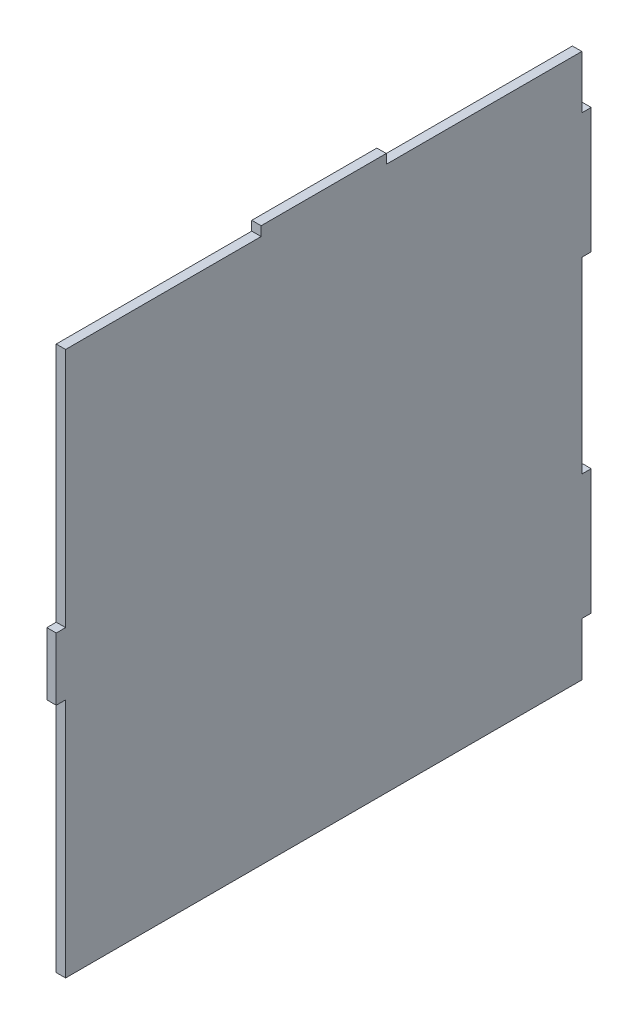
SolidWorks part; units mm, degrees
ref_plane "Front Plane" through (0, 0, 0) normal (0, 0, 1) x (1, 0, 0)
ref_plane "Top Plane" through (0, 0, 0) normal (0, 1, 0) x (1, 0, 0)
ref_plane "Right Plane" through (0, 0, 0) normal (1, 0, 0) x (0, 0, -1)
sketch "Sketch1" plane through (0, 0, 0) normal (0, 0, 1) x (1, 0, 0)
  line L1 (-1317.4158, 414.511) -> (-1311.4158, 414.511)
  line L2 (-1317.4158, 414.511) -> (-1317.4158, 66.511)
  line L3 (-1317.4158, 66.511) -> (-1311.4158, 66.511)
  line L4 (-1311.4158, 414.511) -> (-1311.4158, 66.511)
  line L6 (-1317.4158, 380.511) -> (-1311.4158, 380.511)
  line L7 (-1317.4158, 380.511) -> (-1317.4158, 300.511)
  line L8 (-1317.4158, 300.511) -> (-1311.4158, 300.511)
  line L9 (-1311.4158, 380.511) -> (-1311.4158, 300.511)
  line L10 (-1317.4158, 180.511) -> (-1311.4158, 180.511)
  line L11 (-1317.4158, 180.511) -> (-1317.4158, 100.511)
  line L12 (-1317.4158, 100.511) -> (-1311.4158, 100.511)
  line L13 (-1311.4158, 180.511) -> (-1311.4158, 100.511)
  dimension "D1" = 6
extrude "Boss-Extrude1" add sketch "Sketch1" along normal blind 330 contours L2 L6 L4 L1 | L2 L10 L4 L8 | L12 L2 L3 L4
sketch "Sketch2" plane through (-1311.4158, 0, 0) normal (1, 0, 0) x (0, 0, -1)
  line L0 (-330, 300.511) -> (0, 300.511) construction
  line L1 (0, 380.511) -> (6, 380.511)
  line L3 (0, 300.511) -> (6, 300.511)
  line L4 (6, 380.511) -> (6, 300.511)
  line L5 (0, 100.511) -> (0, 66.511) construction
  line L6 (0, 180.511) -> (6, 180.511)
  line L8 (0, 100.511) -> (6, 100.511)
  line L9 (6, 180.511) -> (6, 100.511)
  line L10 (0, 300.511) -> (0, 180.511)
  line L11 (-330, 414.511) -> (0, 414.511)
  line L12 (-330, 414.511) -> (-330, 66.511)
  line L13 (-330, 66.511) -> (0, 66.511)
  line L14 (0, 414.511) -> (0, 380.511)
  line L15 (0, 100.511) -> (0, 66.511)
  line L17 (-336, 220.511) -> (-324, 220.511)
  line L18 (-336, 220.511) -> (-336, 260.511)
  line L19 (-336, 260.511) -> (-324, 260.511)
  line L20 (-324, 220.511) -> (-324, 260.511)
  line L21 (-336, 220.511) -> (-324, 260.511) construction
  line L22 (-336, 260.511) -> (-324, 220.511) construction
  line L23 (-205, 408.511) -> (-125, 408.511)
  line L24 (-205, 408.511) -> (-205, 420.511)
  line L25 (-205, 420.511) -> (-125, 420.511)
  line L26 (-125, 408.511) -> (-125, 420.511)
  line L27 (-205, 408.511) -> (-125, 420.511) construction
  line L28 (-205, 420.511) -> (-125, 408.511) construction
  point P5 (-330, 240.511)
  point P25 (-165, 414.511)
  dimension "D1" = 6
  dimension "D2" = 6
  dimension "D3" = 12
  dimension "D4" = 40
  dimension "D5" = 12
  dimension "D6" = 80
extrude "Boss-Extrude2" add sketch "Sketch2" against normal up to surface (6 mm away) contours L19 L18 L17 L12 | L20 L17 L12 L13 L15 L8 L9 L6 L10 L3 L4 L1 L19 M6 | L11 L26 L25 L24
sketch "Sketch3" plane through (0, 0, 330) normal (0, 0, 1) x (1, 0, 0)
  line L0 (-1317.4158, 414.511) -> (-1317.4158, 380.511) construction
  line L1 (-1317.4158, 384.502) -> (-1311.4158, 384.502)
  line L2 (-1317.4158, 384.502) -> (-1317.4158, 374.8093)
  line L3 (-1317.4158, 374.8093) -> (-1311.4158, 374.8093)
  line L4 (-1311.4158, 384.502) -> (-1311.4158, 374.8093)
  line L5 (-1311.4158, 380.511) -> (-1311.4158, 260.511) construction
extrude "Boss-Extrude3" add sketch "Sketch3" against normal up to surface (330 mm away)
sketch "Sketch4" plane through (-1317.4158, 0, 0) normal (-1, 0, 0) x (0, 0, 1)
  line L1 (125, 420.511) -> (205, 420.511)
  line L2 (125, 420.511) -> (125, 412.2545)
  line L3 (125, 412.2545) -> (205, 412.2545)
  line L4 (205, 420.511) -> (205, 412.2545)
extrude "Boss-Extrude4" add sketch "Sketch4" against normal up to surface (6 mm away)
